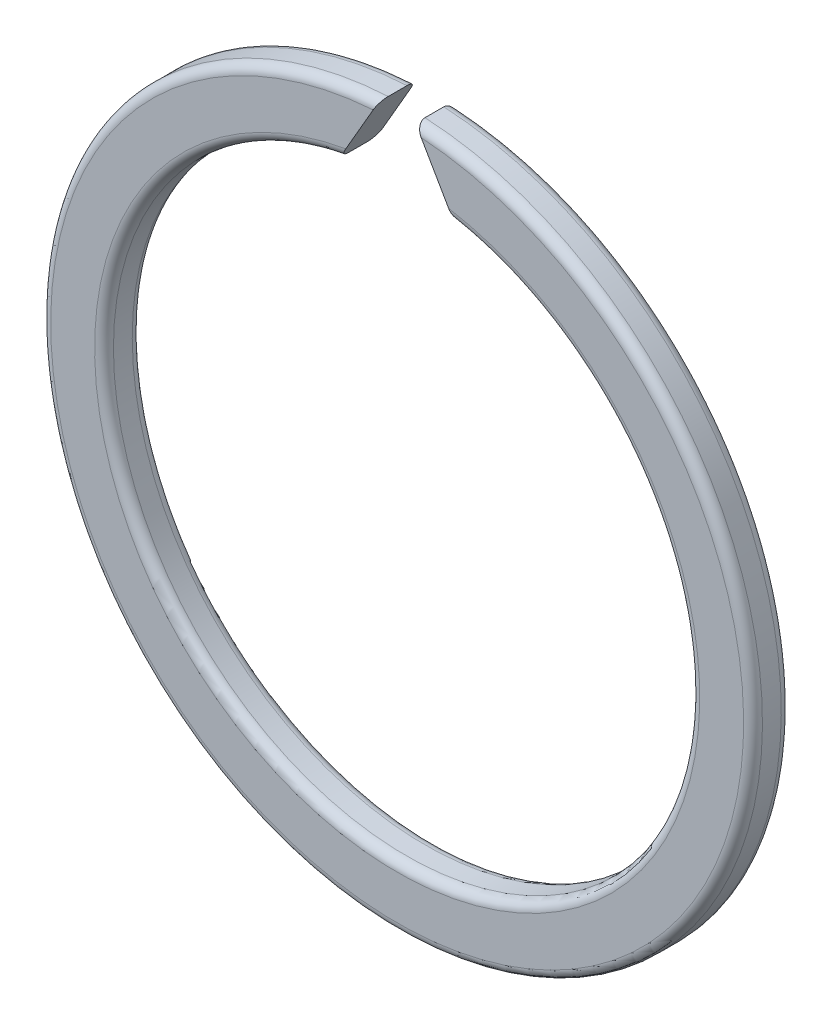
SolidWorks part; units mm, degrees
ref_plane "Front Plane" through (0, 0, 0) normal (0, 0, 1) x (1, 0, 0)
ref_plane "Top Plane" through (0, 0, 0) normal (0, 1, 0) x (1, 0, 0)
ref_plane "Right Plane" through (0, 0, 0) normal (1, 0, 0) x (0, 0, -1)
sketch "BodySke" plane through (0, 0, 0) normal (0, 0, 1) x (1, 0, 0)
  circle A0 centre (0, 0) radius 9.35
  circle A1 centre (0, 0) radius 11.35
  dimension "Groove_Diameter" = 18.7
  dimension "Groove_Width" = 2
extrude "BaseBody" add sketch "BodySke" along normal blind 1.2
sketch "SlitSke" plane through (0, 0, 0) normal (0, 0, 1) x (1, 0, 0)
  line L0 (0, 0) -> (0, 17.3673) construction
  line L1 (0, 12.35) -> (-1.8373, 9.1677)
  line L2 (-1.8373, 9.1677) -> (1.8373, 9.1677)
  line L3 (0, 12.35) -> (1.8373, 9.1677)
  circle A0 centre (0, 0) radius 9.35 construction
  point P9 (0, 9.1677)
  dimension "Angle" = 60
  dimension "D2" = 12.35
extrude "Slit" cut sketch "SlitSke" along normal through all
fillet "Fillet1" radius 0.3 4 edges at (0, -9.35, 0) (0, -11.35, 0) (0, -9.35, 1.2) (0, -11.35, 1.2)
equation "\"D2@SlitSke\" = \"Groove_Diameter@BodySke\" / 2 + \"Groove_Width@BodySke\" * 1.5"
